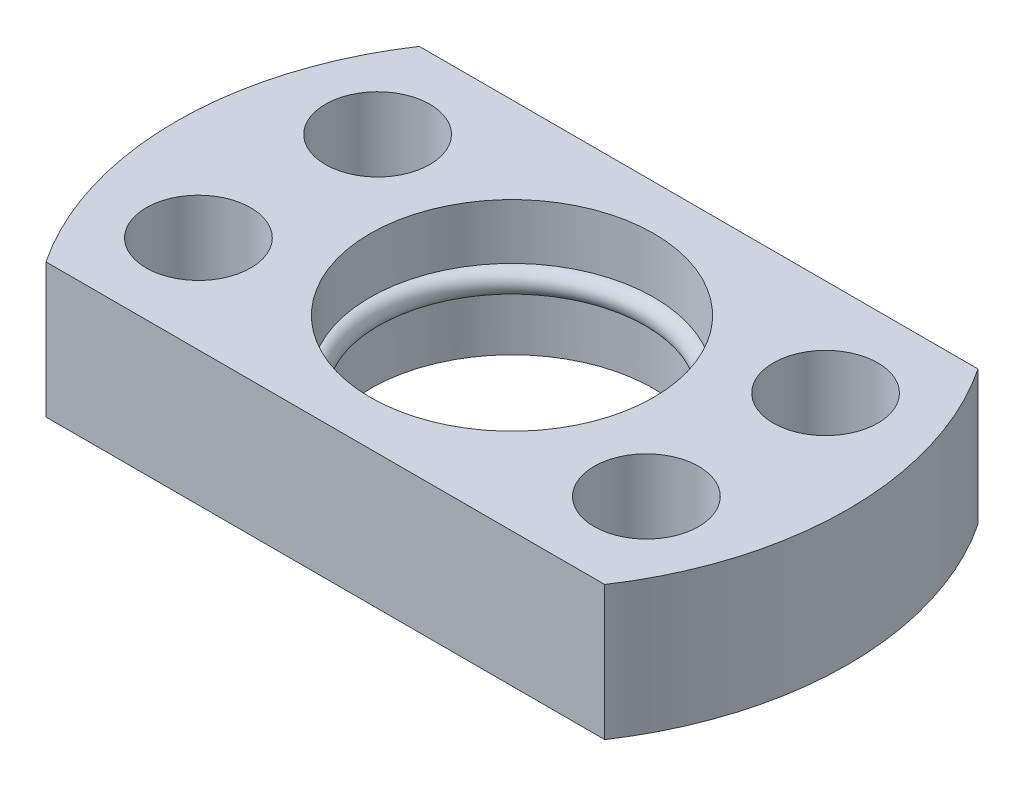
SolidWorks part; units mm, degrees
ref_plane "Front Plane" through (0, 0, 0) normal (0, 0, 1) x (1, 0, 0)
ref_plane "Top Plane" through (0, 0, 0) normal (0, 1, 0) x (1, 0, 0)
ref_plane "Right Plane" through (0, 0, 0) normal (1, 0, 0) x (0, 0, -1)
sketch "Sketch2" plane through (0, 0, 0) normal (0, 1, 0) x (1, 0, 0)
  line L0 (-18.7083, 12.5) -> (18.7083, 12.5)
  line L1 (-18.7083, -12.5) -> (18.7083, -12.5)
  line L3 (-15, -6) -> (15, -6) construction
  line L4 (-15, -6) -> (-15, 6) construction
  line L5 (-15, 6) -> (15, 6) construction
  line L6 (15, -6) -> (15, 6) construction
  line L7 (-15, -6) -> (15, 6) construction
  line L8 (-15, 6) -> (15, -6) construction
  circle A0 centre (0, 0) radius 9.5
  arc A1 (-18.7083, 12.5) -> (-18.7083, -12.5) centre (0, 0) ccw
  arc A2 (18.7083, -12.5) -> (18.7083, 12.5) centre (0, 0) ccw
  circle A3 centre (-15, 6) radius 3.5
  circle A4 centre (15, 6) radius 3.5
  circle A5 centre (-15, -6) radius 3.5
  circle A6 centre (15, -6) radius 3.5
  dimension "D1" = 19
  dimension "D2" = 45
  dimension "D4" = 7
  dimension "D3" = 25
  dimension "D6" = 30
  dimension "D7" = 12
extrude "Boss-Extrude1" add sketch "Sketch2" along normal mid plane 9
sketch "Sketch3" plane through (0, 0, 0) normal (0, 0, 1) x (1, 0, 0)
  line L0 (-9.5, 0) -> (0, 0) construction
  line L1 (-18.7083, 4.5) -> (18.7083, 4.5) construction
  line L2 (0, 0) -> (0, 4.5) construction
  circle A0 centre (-9.5, 0) radius 0.8
  dimension "D1" = 19
  dimension "D2" = 1.6
revolve "Revolve1" add sketch "Sketch3" angle 360 about L2
